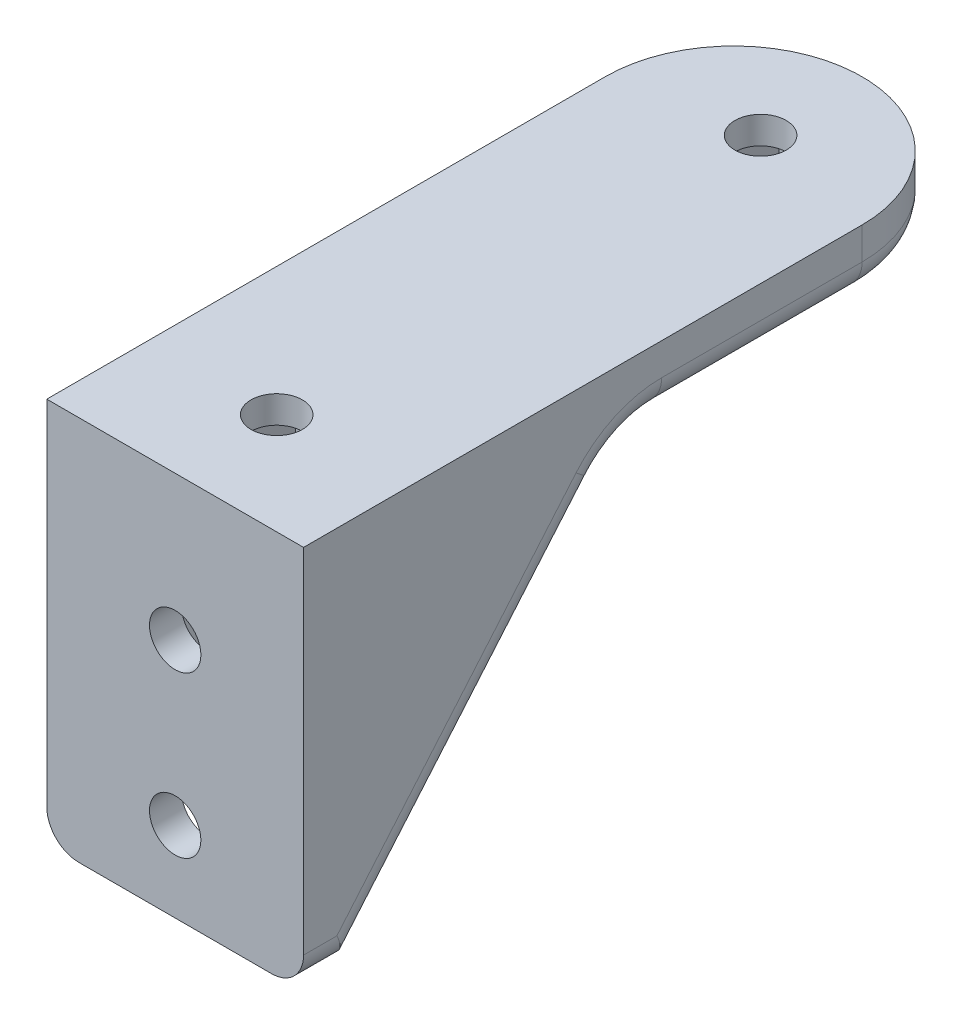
SolidWorks part; units mm, degrees
ref_plane "Plan de face" through (0, 0, 0) normal (0, 0, 1) x (1, 0, 0)
ref_plane "Plan de dessus" through (0, 0, 0) normal (0, 1, 0) x (1, 0, 0)
ref_plane "Plan de droite" through (0, 0, 0) normal (1, 0, 0) x (0, 0, -1)
sketch "Esquisse1" plane through (0, 0, 0) normal (0, 1, 0) x (1, 0, 0)
  line L0 (0, -35.0668) -> (0, 34.2728) construction
  line L1 (8, 45.1934) -> (8, -28.5294) construction
  line L2 (33.4524, 0) -> (-22.243, 0) construction
  line L3 (22.1271, 15.075) -> (-23.7404, 15.075) construction
  line L4 (43.6486, 21.4) -> (0, 21.4) construction
  line L5 (14.4183, 13.4) -> (-35.2607, 13.4) construction
  line L6 (42.684, -21.4) -> (-15.5604, -21.4) construction
  line L7 (8, 13.4) -> (8, -21.4)
  line L8 (8, -21.4) -> (-8, -21.4)
  line L9 (-8, -21.4) -> (-8, 13.4)
  circle A0 centre (0, 15.075) radius 1.6
  arc A1 (8, 13.4) -> (-8, 13.4) centre (0, 13.4) ccw
  circle A2 centre (0, -15.075) radius 1.6
  point P30 (0, 0)
  point P59 (0, 0)
  dimension "D4" = 42.8
  dimension "D1" = 21.4
  dimension "D2" = 15.075
  dimension "D3" = 8
  dimension "D5" = 8
extrude "Boss.-Extru.1" add sketch "Esquisse1" along normal blind 4
sketch "Esquisse5" plane through (0, 0, 0) normal (0, -1, 0) x (1, 0, 0)
  line L1 (-3.1754, -15.075) -> (-1.5877, -17.825)
  line L2 (-1.5877, -17.825) -> (1.5877, -17.825)
  line L3 (1.5877, -17.825) -> (3.1754, -15.075)
  line L4 (3.1754, -15.075) -> (1.5877, -12.325)
  line L5 (1.5877, -12.325) -> (-1.5877, -12.325)
  line L6 (-1.5877, -12.325) -> (-3.1754, -15.075)
  line L7 (-3.1754, 15.075) -> (-1.5877, 12.325)
  line L8 (-1.5877, 12.325) -> (1.5877, 12.325)
  line L9 (1.5877, 12.325) -> (3.1754, 15.075)
  line L10 (3.1754, 15.075) -> (1.5877, 17.825)
  line L11 (1.5877, 17.825) -> (-1.5877, 17.825)
  line L12 (-1.5877, 17.825) -> (-3.1754, 15.075)
  circle A0 centre (0, -15.075) radius 2.75 construction
  circle A1 centre (0, 15.075) radius 2.75 construction
extrude "Enlèv. mat.-Extru.3" cut sketch "Esquisse5" against normal blind 2.3
sketch "Esquisse6" plane through (0, 0, 0) normal (0, -1, 0) x (1, 0, 0)
  line L0 (-8, -13.4) -> (-8, 21.4) construction
  line L1 (8, 21.4) -> (-8, 21.4)
  line L2 (8, 21.4) -> (8, 1.4)
  line L3 (-6, 18.4) -> (-6, 1.4)
  line L4 (-8, 21.4) -> (-8, 1.4)
  line L5 (8, 24.5167) -> (8, -6.8909) construction
  line L6 (8, 21.4) -> (8, -13.4) construction
  line L7 (13.897, 21.4) -> (-9.1897, 21.4) construction
  line L8 (13.897, 1.4) -> (-9.1897, 1.4) construction
  line L9 (6, 24.5167) -> (6, -0.9749) construction
  line L10 (0, 24.0357) -> (0, -3.5241) construction
  line L11 (6, 18.4) -> (6, 1.4)
  line L12 (6, 1.4) -> (8, 1.4)
  line L13 (-6, 1.4) -> (-8, 1.4)
  line L14 (6, 18.4) -> (-6, 18.4)
  dimension "D1" = 2
  dimension "D2" = 20
extrude "Boss.-Extru.2" add sketch "Esquisse6" along normal blind 20
sketch "Esquisse7" plane through (0, 0, 18.4) normal (0, 0, -1) x (-1, 0, 0)
  line L0 (11.3336, -10) -> (-9.2388, -10) construction
  line L1 (11.3336, -5) -> (-9.2388, -5) construction
  line L2 (0, -22.658) -> (0, -2.0506) construction
  circle A0 centre (0, -5) radius 1.6
  circle A1 centre (0, -15) radius 1.6
  dimension "D1" = 5
extrude "Enlèv. mat.-Extru.4" cut sketch "Esquisse7" against normal blind 3
sketch "Esquisse8" plane through (0, 0, 18.4) normal (0, 0, -1) x (-1, 0, 0)
  circle A0 centre (0, -5) radius 4.1
  circle A1 centre (0, -15) radius 4.1
extrude "Enlèv. mat.-Extru.5" cut sketch "Esquisse8" against normal blind 1
sketch "Esquisse10" plane through (8, 0, 0) normal (1, 0, 0) x (0, 0, -1)
  line L0 (-21.4, -24.9476) -> (-21.4, 5.0861) construction
  line L1 (-18.4, -24.9476) -> (-18.4, -17.5311) construction
  line L2 (-18.4, -20) -> (-1.4, 0)
  line L3 (-1.4, 0) -> (-1.4, -20)
  line L4 (-1.4, -20) -> (-18.4, -20)
  dimension "D1" = 3
extrude "Enlèv. mat.-Extru.6" cut sketch "Esquisse10" against normal through all
fillet "Congé3" radius 1 4 edges at (-6, 0, 9.9) (-6, -10, 18.4) (6, 0, 9.9) (6, -10, 18.4)
fillet "Congé4" radius 5 2 edges
fillet "Congé5" radius 2 9 edges at (-8, -0.4618, 1.1865) (0, 0, -21.4) (8, -0.4618, 1.1865) (-8, -20, 19.9) (8, -20, 19.9)
